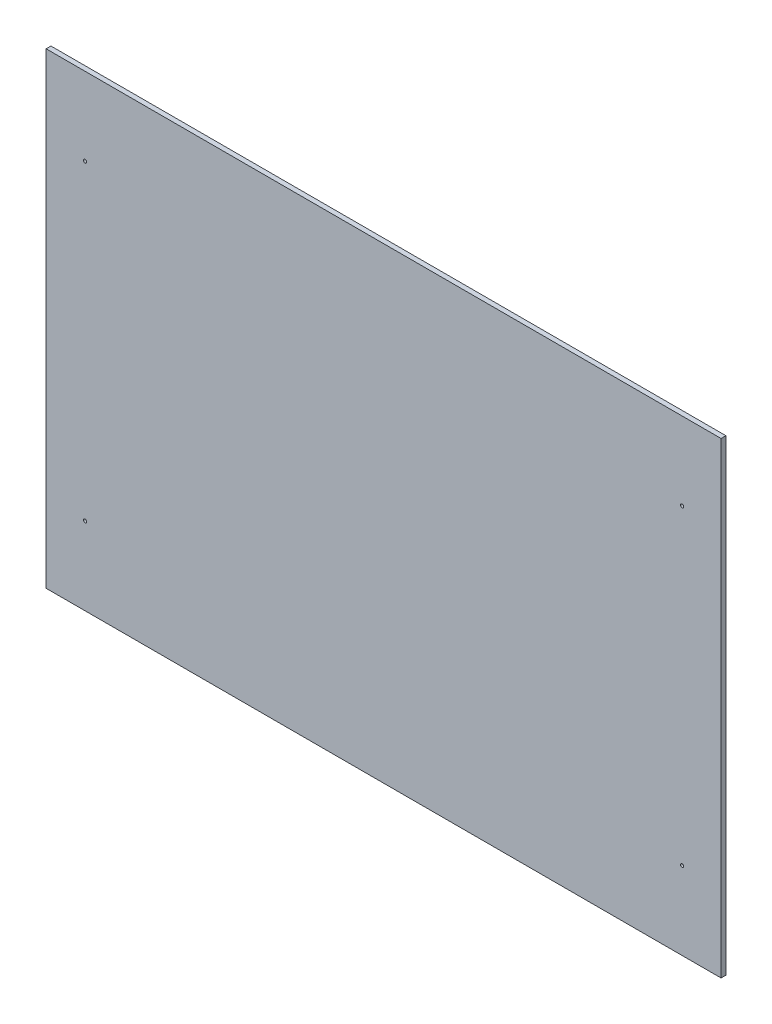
SolidWorks part; units mm, degrees
ref_plane "Front Plane" through (0, 0, 0) normal (0, 0, 1) x (1, 0, 0)
ref_plane "Top Plane" through (0, 0, 0) normal (0, 1, 0) x (1, 0, 0)
ref_plane "Right Plane" through (0, 0, 0) normal (1, 0, 0) x (0, 0, -1)
sketch "Sketch1" plane through (0, 0, 0) normal (0, 0, 1) x (1, 0, 0)
  line L1 (0, 0) -> (330.2, 0)
  line L2 (0, 0) -> (0, 228.6)
  line L3 (0, 228.6) -> (330.2, 228.6)
  line L4 (330.2, 0) -> (330.2, 228.6)
  dimension "D1" = 228.6
  dimension "D2" = 330.2
extrude "Boss-Extrude1" add sketch "Sketch1" along normal blind 2.3622
hole_wizard "1/16 (0.0625) Diameter Hole1" positions "Sketch4" profile "Sketch3" hole size "1/16" standard "ANSI Inch"
sketch "Sketch4" plane through (0, 0, 2.3622) normal (0, 0, 1) x (1, 0, 0)
  point P0 (19.05, 190.5)
  point P2 (311.15, 190.5)
  point P4 (19.05, 38.1)
  point P6 (311.15, 38.1)
  point P17 (0, 0)
  point P18 (0, 0)
  dimension "D1" = 38.1
  dimension "D2" = 38.1
  dimension "D3" = 19.05
  dimension "D4" = 19.05
sketch "Sketch3" plane through (19.05, 190.5, 2.3622) normal (1, 0, 0) x (0, -1, 0)
  line L0 (0, 0) -> (0, 2.3622)
  line L1 (0, 2.3622) -> (0.7937, 2.3622)
  line L2 (0.7937, 2.3622) -> (0.7937, 0)
  line L5 (0.7937, 0) -> (0, 0)
  line L11 (0, -6.35) -> (0, 107.95) construction
  dimension "Thru Hole Dia." = 1.5875
  dimension "Thru Hole Depth" = 2.3622
